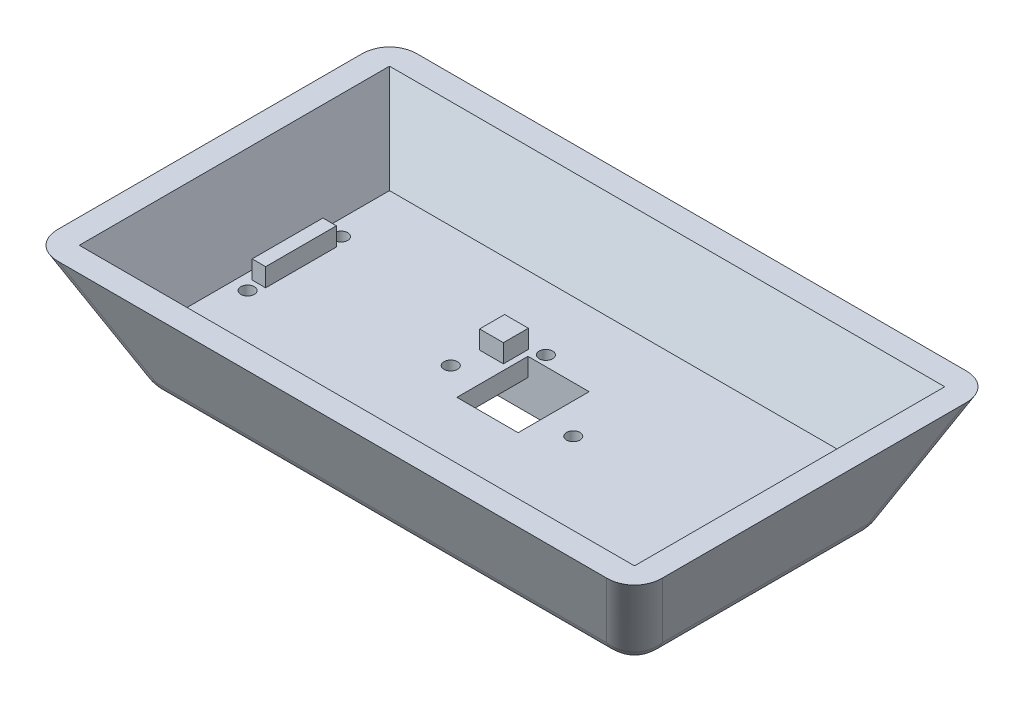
SolidWorks part; units mm, degrees
ref_plane "Front Plane" through (0, 0, 0) normal (0, 0, 1) x (1, 0, 0)
ref_plane "Top Plane" through (0, 0, 0) normal (0, 1, 0) x (1, 0, 0)
ref_plane "Right Plane" through (0, 0, 0) normal (1, 0, 0) x (0, 0, -1)
sketch "Sketch1" plane through (0, 0, 0) normal (0, 1, 0) x (1, 0, 0)
  line L1 (-40, 20) -> (40, 20)
  line L2 (-40, 20) -> (-40, -20)
  line L3 (-40, -20) -> (40, -20)
  line L4 (40, 20) -> (40, -20)
  line L5 (-40, 20) -> (40, -20) construction
  line L6 (-40, -20) -> (40, 20) construction
  point P0 (0, 0)
  dimension "D1" = 40
  dimension "D2" = 80
extrude "Boss-Extrude1" add sketch "Sketch1" along normal blind 20 draft 25
sketch "Sketch2" plane through (0, 0, 0) normal (0, -1, 0) x (1, 0, 0)
  line L1 (-15.1, 7.6) -> (15.1, 7.6)
  line L2 (-15.1, 7.6) -> (-15.1, -7.6)
  line L3 (-15.1, -7.6) -> (15.1, -7.6)
  line L4 (15.1, 7.6) -> (15.1, -7.6)
  line L5 (-15.1, 7.6) -> (15.1, -7.6) construction
  line L6 (-15.1, -7.6) -> (15.1, 7.6) construction
  point P0 (0, 0)
  dimension "D1" = 15.2
  dimension "D2" = 30.2
extrude "Cut-Extrude1" cut sketch "Sketch2" against normal blind 5
sketch "Sketch3" plane through (0, 20, 0) normal (0, 1, 0) x (1, 0, 0)
  line L17 (-45.3262, 25.3262) -> (-45.3262, -25.3262)
  line L18 (-45.3262, -25.3262) -> (45.3262, -25.3262)
  line L19 (45.3262, -25.3262) -> (45.3262, 25.3262)
  line L20 (45.3262, 25.3262) -> (-45.3262, 25.3262)
  line L21 (-45.3262, 25.3262) -> (-45.3262, -25.3262)
  line L22 (-45.3262, -25.3262) -> (45.3262, -25.3262)
  line L23 (45.3262, -25.3262) -> (45.3262, 25.3262)
  line L24 (45.3262, 25.3262) -> (-45.3262, 25.3262)
  dimension "D2" = 4
extrude "Cut-Extrude3" cut sketch "Sketch3" against normal blind 12 draft 25
sketch "Sketch5" plane through (0, 5, 0) normal (0, -1, 0) x (1, 0, 0)
  line L0 (0, 0) -> (-10, 0) construction
  line L1 (0, 0) -> (10, 0) construction
  line L2 (-5, 0) -> (-5, 4) construction
  line L4 (-5, 4) -> (5, 4) construction
  line L5 (-15.1, -7.6) -> (15.1, -7.6) construction
  line L6 (5, 4) -> (-5, 4)
  line L7 (5, 4) -> (5, -7.6)
  line L8 (5, -7.6) -> (-5, -7.6)
  line L9 (-5, 4) -> (-5, -7.6)
  circle A0 centre (-10, 0) radius 1.1
  circle A1 centre (10, 0) radius 1.1
  dimension "D3" = 2.2
  dimension "D4" = 2.2
  dimension "D1" = 10
  dimension "D2" = 10
  dimension "D5" = 4
  dimension "D6" = 10
extrude "Cut-Extrude4" cut sketch "Sketch5" against normal up to next
sketch "Sketch6" plane through (0, 8, 0) normal (0, 1, 0) x (1, 0, 0)
  line L0 (-5, 1.8) -> (-39.7305, 1.8) construction
  line L1 (-5, -4) -> (-5, 7.6) construction
  line L2 (-39.7305, 19.7305) -> (-39.7305, -19.7305) construction
  line L3 (-39.7305, 1.8) -> (-39.7305, -8.7) construction
  line L4 (-39.7305, -8.7) -> (-1.7305, -8.7) construction
  line L5 (-39.7305, 1.8) -> (-39.7305, 12.3) construction
  line L6 (-39.7305, -8.7) -> (-39.7305, -5.98) construction
  line L7 (-39.7305, 12.3) -> (-1.7305, 12.3)
  line L8 (-39.7305, 12.3) -> (-39.7305, -8.7)
  line L9 (-39.7305, -8.7) -> (-1.7305, -8.7)
  line L10 (-1.7305, 12.3) -> (-1.7305, -8.7)
  line L11 (-39.7305, -5.98) -> (-37.1905, -5.98) construction
  line L12 (-39.7305, -8.7) -> (-39.7305, 9.27) construction
  line L13 (-39.7305, 9.27) -> (-37.1905, 9.27) construction
  line L14 (-39.7305, 9.27) -> (-3.7305, 9.27) construction
  circle A0 centre (-37.1905, -5.98) radius 1.1
  circle A1 centre (-37.1905, 9.27) radius 1.1
  circle A2 centre (-3.7305, 9.27) radius 1.1
  point P18 (0, 0)
  dimension "D1" = 2.2
  dimension "D2" = 2.2
  dimension "D3" = 2.2
extrude "Cut-Extrude5" cut sketch "Sketch6" against normal blind 4.75 contours A1 | A0 | A2
sketch "Sketch7" plane through (0, 8, 0) normal (0, 1, 0) x (1, 0, 0)
  line L1 (-38.2905, 9.27) -> (-38.2905, -5.98) construction
  line L2 (-36.0905, 9.27) -> (-36.0905, -5.98) construction
  line L3 (-37.1905, 8.17) -> (-37.1905, 7.42) construction
  line L4 (-37.1905, -4.88) -> (-37.1905, -4.13) construction
  line L6 (-38.2905, 7.42) -> (-36.0905, 7.42)
  line L7 (-38.2905, 7.42) -> (-38.2905, -4.13)
  line L8 (-38.2905, -4.13) -> (-36.0905, -4.13)
  line L9 (-36.0905, 7.42) -> (-36.0905, -4.13)
  line L10 (-9.8176, 8.6092) -> (-5.9359, 8.6092)
  line L11 (-9.8176, 8.6092) -> (-9.8176, 4.53)
  line L12 (-9.8176, 4.53) -> (-5.9359, 4.53)
  line L13 (-5.9359, 8.6092) -> (-5.9359, 4.53)
  circle A0 centre (-37.1905, 9.27) radius 1.1 construction
  circle A1 centre (-37.1905, 9.27) radius 1.1 construction
  circle A2 centre (-37.1905, -5.98) radius 1.1 construction
  circle A3 centre (-37.1905, -5.98) radius 1.1 construction
  dimension "D1" = 0.75
extrude "Boss-Extrude3" add sketch "Sketch7" along normal blind 3
fillet "Fillet1" radius 5 8 edges at (-40, 0, 0) (0, 0, 20) (40, 0, 0) (0, 0, -20) (-44.6631, 10, 24.6631) (44.6631, 10, 24.6631) (44.6631, 10, -24.6631) (-44.6631, 10, -24.6631)
